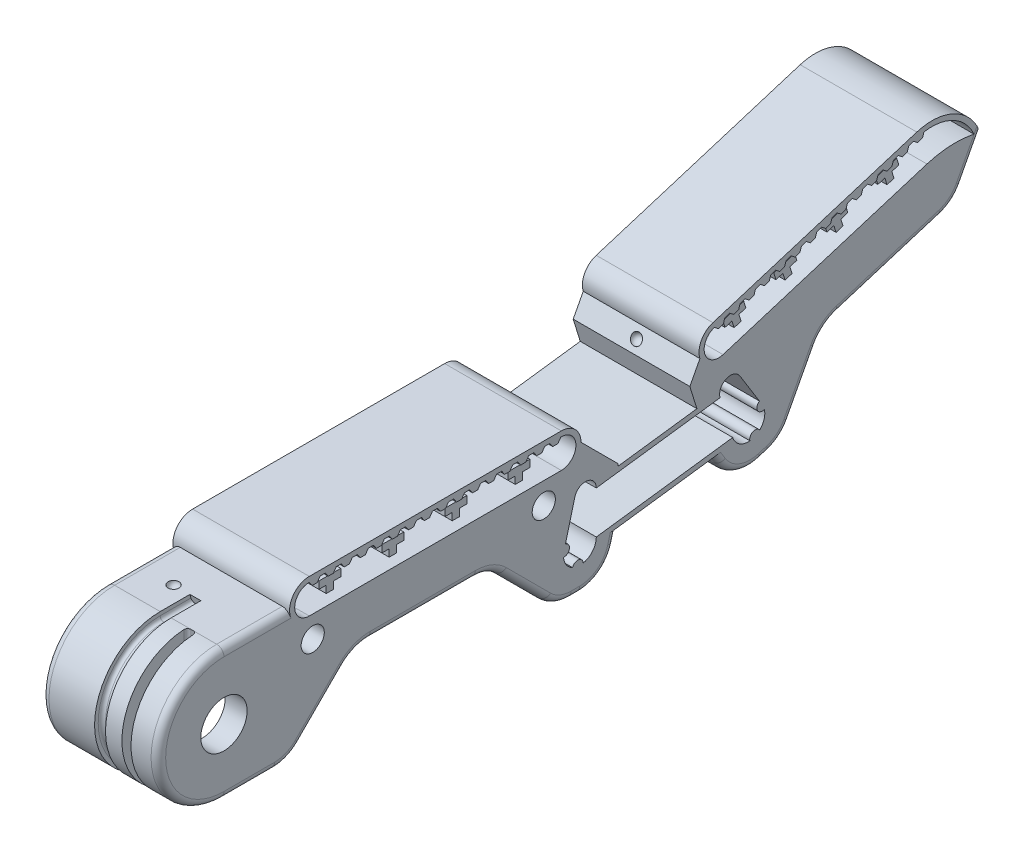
SolidWorks part; units mm, degrees
ref_plane "Front Plane" through (0, 0, 0) normal (0, 0, 1) x (1, 0, 0)
ref_plane "Top Plane" through (0, 0, 0) normal (0, 1, 0) x (1, 0, 0)
ref_plane "Right Plane" through (0, 0, 0) normal (1, 0, 0) x (0, 0, -1)
sketch "Sketch1" plane through (0, 0, 0) normal (1, 0, 0) x (0, 0, -1)
  line L0 (0, 0) -> (54.0462, 0) construction
  line L1 (54.0462, 0) -> (65.9436, 1.5663) construction
  line L2 (65.9436, 1.5663) -> (98.4935, 11.6394) construction
  line L3 (0, 0) -> (59.9949, 0.7832) construction
  line L4 (59.9949, 0.7832) -> (98.4935, 11.6394) construction
  line L5 (0, 3.175) -> (0, -3.175) construction
  line L6 (0, 9) -> (54.0462, 9)
  line L7 (0, -9) -> (54.0462, -9)
  line L8 (54.0462, 9) -> (54.0462, -9) construction
  line L9 (63.2829, 10.164) -> (95.8328, 20.2371)
  line L10 (68.6042, -7.0314) -> (101.1542, 3.0416)
  line L11 (101.1542, 3.0416) -> (95.8328, 20.2371)
  line L12 (63.2829, 10.164) -> (68.6042, -7.0314) construction
  line L13 (54.0462, 9) -> (54.0462, 3.615)
  line L14 (54.0462, 3.615) -> (64.8686, 5.0398)
  line L15 (64.8686, 5.0398) -> (63.2829, 10.164)
  line L16 (54.0462, -9) -> (54.0462, -3.615)
  line L17 (54.0462, -3.615) -> (67.0185, -1.9072)
  line L18 (67.0185, -1.9072) -> (68.6042, -7.0314)
  line L19 (54.0462, 9) -> (63.2829, 10.164) construction
  line L20 (54.0462, -9) -> (68.6042, -7.0314) construction
  circle A0 centre (0, 0) radius 3.175
  arc A1 (0, 9) -> (0, -9) centre (0, 0) ccw
  dimension "D6" = 6.35
  dimension "D7" = 18
  dimension "D1" = 15
  dimension "D2" = 7.5
  dimension "D3" = 60
  dimension "D4" = 40
  dimension "D5" = 12
  dimension "D8" = 18
  dimension "D9" = 7.1681
extrude "Base" add sketch "Sketch1" along normal mid plane 16
sketch "Sketch2" plane through (8, 0, 0) normal (1, 0, 0) x (0, 0, -1)
  line L0 (59.4574, 4.3274) -> (60.5323, -2.7611) construction
  line L1 (64.8686, 5.0398) -> (54.0462, 3.615) construction
  line L2 (54.0462, -3.615) -> (67.0185, -1.9072) construction
  line L3 (54.0462, 3.615) -> (54.0462, -3.615) construction
  line L4 (64.8686, 5.0398) -> (67.0185, -1.9072) construction
  line L5 (54.0462, 0) -> (65.9436, 1.5663) construction
  line L6 (54.0462, 2.909) -> (65.0786, 4.3614)
  line L7 (54.0462, -2.909) -> (66.8085, -1.2288)
  line L8 (54.0462, 2.909) -> (51.0719, 2.5174)
  line L9 (54.0462, -2.909) -> (51.0719, -3.3005)
  line L10 (48.1209, 2.8978) -> (46.6454, -2.7299)
  line L11 (51.0719, 2.5174) -> (51.0719, -3.3005) construction
  line L12 (65.0786, 4.3614) -> (68.0529, 4.753)
  line L13 (66.8085, -1.2288) -> (69.7829, -0.8372)
  line L14 (70.7607, 5.9869) -> (73.8445, 1.0137)
  line L15 (68.0529, 4.753) -> (69.7829, -0.8372) construction
  arc A0 (51.0719, 2.5174) -> (48.1209, 2.8978) centre (49.5719, 2.5174) ccw
  arc A1 (51.0719, -3.3005) -> (46.6454, -2.7299) centre (48.8219, -3.3005) cw
  arc A2 (68.0529, 4.753) -> (70.7607, 5.9869) centre (69.4859, 5.1964) cw
  arc A3 (69.7829, -0.8372) -> (73.8445, 1.0137) centre (71.9323, -0.172) ccw
  point P14 (59.9949, 0.7832)
  dimension "D3" = 1.5
  dimension "D4" = 2.25
  dimension "D1" = 0.7
  dimension "D2" = 3
extrude "Flexure" cut sketch "Sketch2" against normal through all
sketch "Sketch3" plane through (8, 0, 0) normal (1, 0, 0) x (0, 0, -1)
  line L0 (46.6454, -2.7299) -> (51.0719, -3.3005) construction
  line L1 (69.7829, -0.8372) -> (73.8445, 1.0137) construction
  line L2 (48.8587, -3.0152) -> (48.5342, -5.5321) construction
  line L3 (71.8137, 0.0883) -> (72.8653, -2.2194) construction
  arc A0 (46.6454, -2.7299) -> (51.0719, -3.3005) centre (48.8219, -3.3005) ccw construction
  arc A1 (69.7829, -0.8372) -> (73.8445, 1.0137) centre (71.9323, -0.172) ccw construction
  circle A2 centre (46.6454, -2.7299) radius 0.75
  circle A3 centre (48.5342, -5.5321) radius 0.75
  circle A4 centre (72.8653, -2.2194) radius 0.75
  circle A5 centre (73.8445, 1.0137) radius 0.75
  dimension "D1" = 1.5
extrude "Flexure Anchors" add sketch "Sketch3" against normal up to surface (16 mm away)
sketch "Sketch4" plane through (8, 0, 0) normal (1, 0, 0) x (0, 0, -1)
  line L0 (27.0231, -9) -> (27.0231, 9) construction
  line L1 (0, -9) -> (54.0462, -9) construction
  line L2 (54.0462, 9) -> (0, 9) construction
  line L3 (-8.0536, 4.0174) -> (54.0462, 4.0174) construction
  line L4 (54.0462, 3.615) -> (54.0462, 9) construction
  line L5 (48.1209, 2.8978) -> (46.8357, -2.0044) construction
  line L6 (44.9883, 2.8948) -> (51.0934, 9) construction
  line L7 (48.9721, 9) -> (54.0462, 3.9259)
  line L8 (54.0462, 3.9259) -> (54.0462, 9)
  line L9 (54.0462, 9) -> (48.9721, 9)
  line L10 (63.2829, 10.164) -> (63.902, 8.1634)
  line L11 (63.2829, 10.164) -> (64.8686, 5.0398) construction
  line L12 (63.902, 8.1634) -> (65.2835, 10.7831)
  line L13 (95.8328, 20.2371) -> (63.2829, 10.164) construction
  line L14 (65.2835, 10.7831) -> (63.2829, 10.164)
  line L15 (59.5624, 3.6352) -> (60.4274, -2.0689) construction
  line L16 (68.0529, 4.753) -> (51.0719, 2.5174) construction
  line L17 (51.0719, -3.3005) -> (69.7829, -0.8372) construction
  line L18 (59.9949, 0.7832) -> (72.9314, 2.4863) construction
  line L19 (73.4493, 1.6511) -> (70.7607, 5.9869) construction
  arc A0 (0, 9) -> (0, -9) centre (0, 0) ccw construction
  arc A1 (51.0719, 2.5174) -> (48.1209, 2.8978) centre (49.5719, 2.5174) ccw construction
  circle A2 centre (43.8657, 4.0174) radius 1.5875
  circle A3 centre (12.175, 4.0174) radius 1.5875
  circle A6 centre (0, 0) radius 3.175 construction
  point P38 (64.5838, 9.4563)
  dimension "D1" = 3.175
  dimension "D2" = 4.4
  dimension "D5" = 12.175
  dimension "D4" = 1.5
  dimension "D6" = 1.5
  dimension "D7" = 8
extrude "Pin Holes" cut sketch "Sketch4" against normal through all
sketch "Sketch5" plane through (0, 28.9861, -28.9861) normal (0, 0.7071, -0.7071) x (1, 0, 0)
  line L0 (0, 28.2646) -> (0, 35.4404) construction
  line L1 (-8, 28.2646) -> (8, 28.2646) construction
  line L2 (-8, 35.4404) -> (8, 35.4404) construction
  circle A0 centre (0, 29.7646) radius 0.75
  dimension "D1" = 1.5
  dimension "D2" = 1.5
extrude "Tendon Route 1" cut sketch "Sketch5" against normal blind 0.75
sketch "Sketch6" plane through (0, -24.5899, -46.6298) normal (0, 0.4665, 0.8845) x (1, 0, 0)
  line L0 (0, 39.9901) -> (0, 37.0285) construction
  line L1 (-8, 39.9901) -> (8, 39.9901) construction
  line L2 (-8, 37.0285) -> (8, 37.0285) construction
  circle A0 centre (0, 38.4901) radius 0.75
  dimension "D1" = 1.5
  dimension "D2" = 1.5
extrude "Tendon Route 2" cut sketch "Sketch6" against normal blind 0.75
sketch "Sketch10" plane through (8, 0, 0) normal (1, 0, 0) x (0, 0, -1)
  line L0 (11.7, 11.7) -> (46.2721, 11.7)
  line L1 (48.9721, 9) -> (0, 9) construction
  line L2 (9, 9) -> (48.9721, 9)
  line L3 (65.2835, 10.7831) -> (95.8328, 20.2371)
  line L4 (67.0646, 14.1607) -> (95.0346, 22.8164)
  line L5 (95.8328, 20.2371) -> (95.0346, 22.8164) construction
  line L6 (101.1542, 3.0416) -> (95.8328, 20.2371) construction
  line L7 (95.8328, 20.2371) -> (99.1735, 9.4422)
  arc A0 (46.2721, 11.7) -> (48.9721, 9) centre (46.2721, 9) cw
  arc A1 (11.7, 11.7) -> (9, 9) centre (11.7, 9) ccw
  arc A2 (65.2835, 10.7831) -> (67.0646, 14.1607) centre (67.8628, 11.5813) cw
  arc A3 (95.0346, 22.8164) -> (99.1735, 9.4422) centre (97.104, 16.1293) cw
  dimension "D3" = 7
  dimension "D1" = 2.7
  dimension "D2" = 9
extrude "Finger Pad Outline" add sketch "Sketch10" against normal up to surface (16 mm away)
sketch "Sketch11" plane through (8, 0, 0) normal (1, 0, 0) x (0, 0, -1)
  line L0 (82.3148, 6.1037) -> (100.3574, 11.6873)
  line L1 (68.6042, -7.0314) -> (101.1542, 3.0416) construction
  line L2 (76.711, -4.5226) -> (107.8413, 5.1111)
  line L3 (107.8413, 5.1111) -> (103.7911, 18.1987)
  line L4 (68.0529, 4.753) -> (69.7829, -0.8372) construction
  line L5 (68.9179, 1.9579) -> (103.114, 12.5404) construction
  line L6 (82.3148, 6.1037) -> (76.711, -4.5226)
  line L7 (63.902, 8.1634) -> (65.2835, 10.7831) construction
  line L8 (67.0185, -1.9072) -> (68.6042, -7.0314)
  line L9 (68.6042, -7.0314) -> (69.9397, -6.6181)
  line L10 (69.9397, -6.6181) -> (67.0185, -1.9072)
  line L11 (73.4493, 1.6511) -> (70.7607, 5.9869) construction
  line L12 (69.9397, -6.6181) -> (76.711, -4.5226) construction
  line L13 (54.0462, -3.615) -> (52.6344, -9)
  line L14 (0, -9) -> (54.0462, -9) construction
  line L15 (52.6344, -9) -> (54.0462, -9)
  line L16 (54.0462, -9) -> (54.0462, -3.615)
  line L17 (48.1209, 2.8978) -> (46.8357, -2.0044) construction
  line L18 (9, 9) -> (9, -9) construction
  line L19 (0, 0) -> (47.3612, 0) construction
  line L20 (9, -9) -> (18, 0)
  line L21 (18, 0) -> (36.5462, 0)
  line L22 (36.5462, 0) -> (45.5462, -9)
  line L23 (45.5462, -9) -> (52.6344, -9)
  line L24 (48.9721, 9) -> (54.0462, 3.9259) construction
  line L25 (51.0719, 2.5174) -> (51.0719, -3.3005) construction
  line L26 (9, -9) -> (45.5462, -9)
  line L27 (100.3574, 11.6873) -> (103.7911, 18.1987)
  arc A0 (99.1735, 9.4422) -> (95.0346, 22.8164) centre (97.104, 16.1293) ccw construction
  dimension "D1" = 8.5
extrude "Finger Outline" cut sketch "Sketch11" against normal through all
sketch "Sketch12" plane through (8, 0, 0) normal (1, 0, 0) x (0, 0, -1)
  line L0 (9, 9) -> (48.9721, 9) construction
  line L1 (65.2835, 10.7831) -> (101.1095, 21.87) construction
  line L2 (95.0346, 22.8164) -> (67.0646, 14.1607) construction
  line L3 (11.7, 11.7) -> (11.7, 6.3) construction
  line L4 (11.7, 11) -> (46.2721, 11)
  line L5 (46.2721, 11.7) -> (46.2721, 6.3) construction
  line L6 (46.2721, 11.7) -> (11.7, 11.7) construction
  line L7 (11.7, 7) -> (46.2721, 7)
  line L8 (67.0646, 14.1607) -> (68.8973, 8.2385) construction
  line L9 (67.2715, 13.492) -> (95.2416, 22.1477)
  line L10 (68.454, 9.6707) -> (96.4241, 18.3265)
  line L11 (95.0346, 22.8164) -> (97.8556, 13.7007) construction
  line L13 (103.7911, 18.1987) -> (62.4469, 5.4041) construction
  line L14 (63.902, 8.1634) -> (65.2835, 10.7831) construction
  arc A0 (103.7911, 18.1987) -> (95.0346, 22.8164) centre (97.104, 16.1293) ccw construction
  arc A1 (11.7, 11) -> (11.7, 7) centre (11.7, 9) ccw
  arc A2 (46.2721, 11) -> (46.2721, 7) centre (46.2721, 9) cw
  arc A3 (67.2715, 13.492) -> (68.454, 9.6707) centre (67.8628, 11.5813) ccw
  arc A4 (95.2416, 22.1477) -> (102.8782, 18.6489) centre (97.104, 16.1293) cw
  arc A5 (96.4241, 18.3265) -> (102.8782, 18.6489) centre (100.2821, 5.8598) cw
  dimension "D1" = 0.7
  dimension "D2" = 0.7
  dimension "D3" = 0.7
extrude "Finger Pad Cavity" cut sketch "Sketch12" against normal through all
sketch "Sketch15" plane through (0, 0, 0) normal (1, 0, 0) x (0, 0, -1)
  line L0 (28.9861, 11) -> (28.9861, 7) construction
  line L1 (11.7, 7) -> (11.7, 11) construction
  line L2 (46.2721, 11) -> (46.2721, 7) construction
  line L3 (67.2715, 13.492) -> (68.454, 9.6707) construction
  line L4 (95.2416, 22.1477) -> (96.4241, 18.3265) construction
  line L5 (46.2721, 11) -> (11.7, 11) construction
  line L6 (11.7, 7) -> (46.2721, 7) construction
  line L7 (82.4391, 13.9986) -> (81.2565, 17.8198) construction
  line L8 (68.454, 9.6707) -> (96.4241, 18.3265) construction
  line L9 (95.2416, 22.1477) -> (67.2715, 13.492) construction
  line L10 (11.7, 11) -> (28.9861, 11) construction
  line L11 (20.343, 11) -> (20.343, 7) construction
  line L12 (11.7, 9) -> (20.343, 9) construction
  line L13 (16.0215, 9) -> (16.0215, 7) construction
  line L14 (67.2715, 13.492) -> (81.2565, 17.8198) construction
  line L15 (74.264, 15.6559) -> (75.4466, 11.8347) construction
  line L16 (67.8628, 11.5813) -> (74.8553, 13.7453) construction
  line L17 (71.359, 12.6633) -> (71.9503, 10.7527) construction
  line L18 (14.5215, 9) -> (17.5215, 9)
  line L19 (17.5215, 9) -> (17.5215, 8)
  line L20 (17.5215, 8) -> (16.5215, 8)
  line L21 (16.5215, 8) -> (16.5215, 7)
  line L22 (16.5215, 7) -> (15.5215, 7)
  line L23 (15.5215, 7) -> (15.5215, 8)
  line L24 (15.5215, 8) -> (14.5215, 8)
  line L25 (14.5215, 8) -> (14.5215, 9)
  line L26 (24.6645, 9) -> (24.6645, 7) construction
  line L27 (26.1645, 8) -> (26.1645, 9)
  line L28 (25.1645, 8) -> (26.1645, 8)
  line L29 (25.1645, 7) -> (25.1645, 8)
  line L30 (24.1645, 7) -> (25.1645, 7)
  line L31 (24.1645, 8) -> (24.1645, 7)
  line L32 (23.1645, 8) -> (24.1645, 8)
  line L33 (23.1645, 9) -> (23.1645, 8)
  line L34 (26.1645, 9) -> (23.1645, 9)
  line L35 (33.3076, 9) -> (33.3076, 7) construction
  line L36 (31.8076, 9) -> (34.8076, 9)
  line L37 (34.8076, 9) -> (34.8076, 8)
  line L38 (34.8076, 8) -> (33.8076, 8)
  line L39 (33.8076, 8) -> (33.8076, 7)
  line L40 (33.8076, 7) -> (32.8076, 7)
  line L41 (32.8076, 7) -> (32.8076, 8)
  line L42 (32.8076, 8) -> (31.8076, 8)
  line L43 (31.8076, 8) -> (31.8076, 9)
  line L44 (41.9506, 9) -> (41.9506, 7) construction
  line L45 (43.4506, 8) -> (43.4506, 9)
  line L46 (42.4506, 8) -> (43.4506, 8)
  line L47 (42.4506, 7) -> (42.4506, 8)
  line L48 (41.4506, 7) -> (42.4506, 7)
  line L49 (41.4506, 8) -> (41.4506, 7)
  line L50 (40.4506, 8) -> (41.4506, 8)
  line L51 (40.4506, 9) -> (40.4506, 8)
  line L52 (43.4506, 9) -> (40.4506, 9)
  line L53 (69.9261, 12.2199) -> (70.2217, 11.2646)
  line L54 (70.2217, 11.2646) -> (71.177, 11.5602)
  line L55 (71.177, 11.5602) -> (71.4726, 10.6049)
  line L56 (71.4726, 10.6049) -> (72.4279, 10.9005)
  line L57 (72.4279, 10.9005) -> (72.1323, 11.8558)
  line L58 (72.1323, 11.8558) -> (73.0876, 12.1515)
  line L59 (73.0876, 12.1515) -> (72.792, 13.1068)
  line L60 (72.792, 13.1068) -> (69.9261, 12.2199)
  line L61 (78.3515, 14.8272) -> (78.9428, 12.9166) construction
  line L62 (76.9186, 14.3838) -> (79.7845, 15.2707)
  line L63 (77.2142, 13.4285) -> (76.9186, 14.3838)
  line L64 (78.1695, 13.7241) -> (77.2142, 13.4285)
  line L65 (78.4652, 12.7688) -> (78.1695, 13.7241)
  line L66 (79.4205, 13.0645) -> (78.4652, 12.7688)
  line L67 (79.1248, 14.0198) -> (79.4205, 13.0645)
  line L68 (80.0801, 14.3154) -> (79.1248, 14.0198)
  line L69 (79.7845, 15.2707) -> (80.0801, 14.3154)
  line L70 (85.3441, 16.9912) -> (85.9353, 15.0806) construction
  line L71 (83.9111, 16.5477) -> (84.2067, 15.5924)
  line L72 (84.2067, 15.5924) -> (85.162, 15.8881)
  line L73 (85.162, 15.8881) -> (85.4577, 14.9328)
  line L74 (85.4577, 14.9328) -> (86.413, 15.2284)
  line L75 (86.413, 15.2284) -> (86.1173, 16.1837)
  line L76 (86.1173, 16.1837) -> (87.0726, 16.4793)
  line L77 (87.0726, 16.4793) -> (86.777, 17.4346)
  line L78 (86.777, 17.4346) -> (83.9111, 16.5477)
  line L79 (92.3366, 19.1551) -> (92.9278, 17.2445) construction
  line L80 (90.9036, 18.7117) -> (93.7695, 19.5986)
  line L81 (91.1992, 17.7564) -> (90.9036, 18.7117)
  line L82 (92.1545, 18.052) -> (91.1992, 17.7564)
  line L83 (92.4502, 17.0967) -> (92.1545, 18.052)
  line L84 (93.4055, 17.3923) -> (92.4502, 17.0967)
  line L85 (93.1098, 18.3476) -> (93.4055, 17.3923)
  line L86 (94.0651, 18.6432) -> (93.1098, 18.3476)
  line L87 (93.7695, 19.5986) -> (94.0651, 18.6432)
extrude "Finger Pad Hooks" add sketch "Sketch15" along normal mid plane 13
sketch "Sketch16" plane through (8, 0, 0) normal (1, 0, 0) x (0, 0, -1)
  line L0 (11.7, 11.7) -> (11.7, 11) construction
  line L1 (11.7, 11) -> (12.1, 10.4255)
  line L2 (12.1, 10.4255) -> (12.8, 10.4255)
  line L3 (12.8, 10.4255) -> (13.2, 11)
  line L4 (46.2721, 11) -> (11.7, 11) construction
  line L5 (13.2, 11) -> (11.7, 11)
  line L6 (13.9, 11) -> (14.3, 10.4255)
  line L7 (14.3, 10.4255) -> (15, 10.4255)
  line L8 (15, 10.4255) -> (15.4, 11)
  line L9 (15.4, 11) -> (13.9, 11)
  line L10 (16.1, 11) -> (16.5, 10.4255)
  line L11 (16.5, 10.4255) -> (17.2, 10.4255)
  line L12 (17.2, 10.4255) -> (17.6, 11)
  line L13 (17.6, 11) -> (16.1, 11)
  line L14 (18.3, 11) -> (18.7, 10.4255)
  line L15 (18.7, 10.4255) -> (19.4, 10.4255)
  line L16 (19.4, 10.4255) -> (19.8, 11)
  line L17 (19.8, 11) -> (18.3, 11)
  line L18 (20.5, 11) -> (20.9, 10.4255)
  line L19 (20.9, 10.4255) -> (21.6, 10.4255)
  line L20 (21.6, 10.4255) -> (22, 11)
  line L21 (22, 11) -> (20.5, 11)
  line L22 (22.7, 11) -> (23.1, 10.4255)
  line L23 (23.1, 10.4255) -> (23.8, 10.4255)
  line L24 (23.8, 10.4255) -> (24.2, 11)
  line L25 (24.2, 11) -> (22.7, 11)
  line L26 (24.9, 11) -> (25.3, 10.4255)
  line L27 (25.3, 10.4255) -> (26, 10.4255)
  line L28 (26, 10.4255) -> (26.4, 11)
  line L29 (26.4, 11) -> (24.9, 11)
  line L30 (27.1, 11) -> (27.5, 10.4255)
  line L31 (27.5, 10.4255) -> (28.2, 10.4255)
  line L32 (28.2, 10.4255) -> (28.6, 11)
  line L33 (28.6, 11) -> (27.1, 11)
  line L34 (29.3, 11) -> (29.7, 10.4255)
  line L35 (29.7, 10.4255) -> (30.4, 10.4255)
  line L36 (30.4, 10.4255) -> (30.8, 11)
  line L37 (30.8, 11) -> (29.3, 11)
  line L38 (31.5, 11) -> (31.9, 10.4255)
  line L39 (31.9, 10.4255) -> (32.6, 10.4255)
  line L40 (32.6, 10.4255) -> (33, 11)
  line L41 (33, 11) -> (31.5, 11)
  line L42 (33.7, 11) -> (34.1, 10.4255)
  line L43 (34.1, 10.4255) -> (34.8, 10.4255)
  line L44 (34.8, 10.4255) -> (35.2, 11)
  line L45 (35.2, 11) -> (33.7, 11)
  line L46 (35.9, 11) -> (36.3, 10.4255)
  line L47 (36.3, 10.4255) -> (37, 10.4255)
  line L48 (37, 10.4255) -> (37.4, 11)
  line L49 (37.4, 11) -> (35.9, 11)
  line L50 (38.1, 11) -> (38.5, 10.4255)
  line L51 (38.5, 10.4255) -> (39.2, 10.4255)
  line L52 (39.2, 10.4255) -> (39.6, 11)
  line L53 (39.6, 11) -> (38.1, 11)
  line L54 (40.3, 11) -> (40.7, 10.4255)
  line L55 (40.7, 10.4255) -> (41.4, 10.4255)
  line L56 (41.4, 10.4255) -> (41.8, 11)
  line L57 (41.8, 11) -> (40.3, 11)
  line L58 (42.5, 11) -> (42.9, 10.4255)
  line L59 (42.9, 10.4255) -> (43.6, 10.4255)
  line L60 (43.6, 10.4255) -> (44, 11)
  line L61 (44, 11) -> (42.5, 11)
  line L62 (44.7, 11) -> (45.1, 10.4255)
  line L63 (45.1, 10.4255) -> (45.8, 10.4255)
  line L64 (45.8, 10.4255) -> (46.2, 11)
  line L65 (46.2, 11) -> (44.7, 11)
  line L66 (67.0646, 14.1607) -> (67.2715, 13.492) construction
  line L67 (67.2715, 13.492) -> (67.8235, 13.0614)
  line L68 (67.8235, 13.0614) -> (68.4922, 13.2684)
  line L69 (68.4922, 13.2684) -> (68.7045, 13.9354)
  line L70 (95.2416, 22.1477) -> (67.2715, 13.492) construction
  line L71 (68.7045, 13.9354) -> (67.2715, 13.492)
  line L72 (69.3732, 14.1423) -> (69.9251, 13.7118)
  line L73 (69.9251, 13.7118) -> (70.5938, 13.9188)
  line L74 (70.5938, 13.9188) -> (70.8061, 14.5858)
  line L75 (70.8061, 14.5858) -> (69.3732, 14.1423)
  line L76 (69.1662, 14.8111) -> (69.3732, 14.1423) construction
  line L77 (71.4748, 14.7927) -> (72.0268, 14.3622)
  line L78 (72.0268, 14.3622) -> (72.6955, 14.5691)
  line L79 (72.6955, 14.5691) -> (72.9078, 15.2362)
  line L80 (72.9078, 15.2362) -> (71.4748, 14.7927)
  line L81 (71.2679, 15.4614) -> (71.4748, 14.7927) construction
  line L82 (73.5765, 15.4431) -> (74.1285, 15.0126)
  line L83 (74.1285, 15.0126) -> (74.7972, 15.2195)
  line L84 (74.7972, 15.2195) -> (75.0095, 15.8866)
  line L85 (75.0095, 15.8866) -> (73.5765, 15.4431)
  line L86 (73.3696, 16.1118) -> (73.5765, 15.4431) construction
  line L87 (75.6782, 16.0935) -> (76.2301, 15.663)
  line L88 (76.2301, 15.663) -> (76.8988, 15.8699)
  line L89 (76.8988, 15.8699) -> (77.1111, 16.537)
  line L90 (77.1111, 16.537) -> (75.6782, 16.0935)
  line L91 (75.4712, 16.7622) -> (75.6782, 16.0935) construction
  line L92 (77.7798, 16.7439) -> (78.3318, 16.3134)
  line L93 (78.3318, 16.3134) -> (79.0005, 16.5203)
  line L94 (79.0005, 16.5203) -> (79.2128, 17.1873)
  line L95 (79.2128, 17.1873) -> (77.7798, 16.7439)
  line L96 (77.5729, 17.4126) -> (77.7798, 16.7439) construction
  line L97 (79.8815, 17.3943) -> (80.4334, 16.9638)
  line L98 (80.4334, 16.9638) -> (81.1022, 17.1707)
  line L99 (81.1022, 17.1707) -> (81.3145, 17.8377)
  line L100 (81.3145, 17.8377) -> (79.8815, 17.3943)
  line L101 (79.6746, 18.063) -> (79.8815, 17.3943) construction
  line L102 (81.9832, 18.0447) -> (82.5351, 17.6142)
  line L103 (82.5351, 17.6142) -> (83.2038, 17.8211)
  line L104 (83.2038, 17.8211) -> (83.4161, 18.4881)
  line L105 (83.4161, 18.4881) -> (81.9832, 18.0447)
  line L106 (81.7762, 18.7134) -> (81.9832, 18.0447) construction
  line L107 (84.0848, 18.6951) -> (84.6368, 18.2645)
  line L108 (84.6368, 18.2645) -> (85.3055, 18.4715)
  line L109 (85.3055, 18.4715) -> (85.5178, 19.1385)
  line L110 (85.5178, 19.1385) -> (84.0848, 18.6951)
  line L111 (83.8779, 19.3638) -> (84.0848, 18.6951) construction
  line L112 (86.1865, 19.3455) -> (86.7384, 18.9149)
  line L113 (86.7384, 18.9149) -> (87.4072, 19.1219)
  line L114 (87.4072, 19.1219) -> (87.6194, 19.7889)
  line L115 (87.6194, 19.7889) -> (86.1865, 19.3455)
  line L116 (85.9796, 20.0142) -> (86.1865, 19.3455) construction
  line L117 (88.2882, 19.9958) -> (88.8401, 19.5653)
  line L118 (88.8401, 19.5653) -> (89.5088, 19.7723)
  line L119 (89.5088, 19.7723) -> (89.7211, 20.4393)
  line L120 (89.7211, 20.4393) -> (88.2882, 19.9958)
  line L121 (88.0812, 20.6646) -> (88.2882, 19.9958) construction
  line L122 (90.3898, 20.6462) -> (90.9418, 20.2157)
  line L123 (90.9418, 20.2157) -> (91.6105, 20.4227)
  line L124 (91.6105, 20.4227) -> (91.8228, 21.0897)
  line L125 (91.8228, 21.0897) -> (90.3898, 20.6462)
  line L126 (90.1829, 21.3149) -> (90.3898, 20.6462) construction
  line L127 (92.4915, 21.2966) -> (93.0434, 20.8661)
  line L128 (93.0434, 20.8661) -> (93.7121, 21.073)
  line L129 (93.7121, 21.073) -> (93.9244, 21.7401)
  line L130 (93.9244, 21.7401) -> (92.4915, 21.2966)
  line L131 (92.2845, 21.9653) -> (92.4915, 21.2966) construction
  line L132 (94.5932, 21.947) -> (95.1451, 21.5165)
  line L133 (95.1451, 21.5165) -> (95.8138, 21.7234)
  line L134 (95.8138, 21.7234) -> (96.0261, 22.3905)
  line L135 (96.0261, 22.3905) -> (94.5932, 21.947)
  line L136 (94.3862, 22.6157) -> (94.5932, 21.947) construction
  dimension "D1" = 1.5
  dimension "D2" = 0.7
  dimension "D3" = 16
  dimension "D4" = 14
extrude "Ridges" add sketch "Sketch16" against normal up to surface (16 mm away)
sketch "Sketch20" plane through (0, 0, 0) normal (1, 0, 0) x (0, 0, -1)
  line L0 (0, 5) -> (10.1093, 5)
  line L1 (0, -9) -> (0, -5)
  line L2 (0, -9) -> (41.5621, -9)
  line L3 (43.8657, 4.0174) -> (74.7188, 8.0793) construction
  line L4 (12.175, 6.3049) -> (43.8657, 6.3049)
  line L5 (41.5621, -9) -> (46.0153, 3.235)
  line L7 (41.5621, -9) -> (52.6344, -9) construction
  line L8 (80.517, -3.3448) -> (69.9397, -6.6181) construction
  line L9 (80.517, -3.3448) -> (107.4143, 4.9789)
  line L10 (69.9397, -6.6181) -> (76.711, -4.5226) construction
  line L11 (80.517, -3.3448) -> (72.8966, 6.6964)
  line L13 (64.8686, 5.0398) -> (54.0462, 3.615) construction
  line L15 (97.8189, 17.6224) -> (74.0425, 10.2645)
  line L16 (97.8189, 17.6224) -> (107.4143, 4.9789)
  circle A0 centre (0, 0) radius 9 construction
  circle A1 centre (12.175, 4.0174) radius 2.2875 construction
  circle A2 centre (43.8657, 4.0174) radius 2.2875 construction
  arc A3 (12.175, 6.3049) -> (10.1093, 5) centre (12.175, 4.0174) ccw
  arc A4 (0, 9) -> (0, -9) centre (0, 0) ccw construction
  circle A5 centre (0, 0) radius 5 construction
  arc A6 (0, 5) -> (0, -5) centre (0, 0) ccw
  arc A7 (43.8657, 6.3049) -> (46.0153, 3.235) centre (43.8657, 4.0174) cw
  circle A8 centre (12.175, 4.0174) radius 1.5875 construction
  arc A9 (74.0425, 10.2645) -> (72.8966, 6.6964) centre (74.7188, 8.0793) ccw
  dimension "D1" = 0.7
  dimension "D2" = 10
  dimension "D3" = 6
  dimension "D4" = 70
  dimension "D5" = 70
extrude "Finger Back Cutaway" cut sketch "Sketch20" against normal mid plane 10
sketch "Sketch21" plane through (0, 0, 0) normal (1, 0, 0) x (0, 0, -1)
  line L0 (0, 9) -> (11.7, 9) construction
  line L1 (11.2106, 2.7564) -> (3.0472, 9) construction
  line L2 (0, 9) -> (0, -9) construction
  line L3 (0, 0) -> (0, -9) construction
  line L4 (0, 8) -> (4.3547, 8)
  line L5 (3.0472, 10.7356) -> (3.0472, 6.5349) construction
  line L6 (0, -8) -> (0, -9)
  line L7 (4.3547, 8) -> (4.0833, 9)
  line L8 (4.0833, 9) -> (0, 9)
  circle A0 centre (12.175, 4.0174) radius 1.5875 construction
  circle A1 centre (12.175, 4.0174) radius 1.5875 construction
  circle A2 centre (0, 0) radius 9 construction
  arc A3 (0, 9) -> (0, -9) centre (0, 0) ccw construction
  arc A4 (0, 9) -> (0, -9) centre (0, 0) ccw
  arc A5 (0, 8) -> (0, -8) centre (0, 0) ccw
  dimension "D1" = 8
extrude "Tendon Track" cut sketch "Sketch21" against normal mid plane 1.5
sketch "Sketch22" plane through (0, 0, 0) normal (0, 0, -1) x (-1, 0, 0)
  line L0 (-0.75, -9) -> (-5, -9) construction
  line L1 (-4.25, 9) -> (-3, 9)
  line L2 (-4.25, 9) -> (-4.25, -9)
  line L3 (-4.25, -9) -> (-3, -9)
  line L4 (-3, 9) -> (-3, -9)
  line L5 (-8, 9) -> (-0.75, 9) construction
  line L6 (5, -5) -> (-5, -5) construction
  line L7 (5, -5) -> (-5, -5) construction
  line L8 (0, 0) -> (0, -5) construction
  dimension "D1" = 1.25
  dimension "D2" = 3
extrude "Torsion Spring Clearance" cut sketch "Sketch22" against normal through all
sketch "Sketch24" plane through (0, 9, 0) normal (0, 1, 0) x (1, 0, 0)
  line L0 (-8, 4.0833) -> (8, 4.0833) construction
  line L1 (-8, 9) -> (-8, 0) construction
  line L2 (8, 9) -> (8, 0) construction
  line L3 (-0.75, 4.0833) -> (0.75, 4.0833) construction
  line L4 (-0.75, 0) -> (-8, 0) construction
  line L7 (-8, 9) -> (8, 9) construction
  line L9 (-3, 0) -> (-3, 4.0833) construction
  line L10 (0, 0) -> (0, 9) construction
  circle A0 centre (-3, 4.0833) radius 0.75
  dimension "D1" = 1.5
  dimension "D2" = 3
extrude "Torsion Spring Route" cut sketch "Sketch24" against normal blind 0.75
fillet "Tendon Route Fillet" radius 0.75 3 edges at (0, 8.4431, -64.8973) (0, 7.9393, -48.9721) (-3, 8.25, -3.3333)
fillet "Tendon Track Contouring" radius 0.5 8 edges at (0.75, 0, 8) (0.75, 8, -2.1773) (-0.75, 8, -2.1773) (-0.75, 0, 8) (4.25, 7, 0) (3, 7, 0) (-1, -5, 0) (3, -7, 0)
fillet "Finger Contouring" radius 5 14 edges at (0, -4.5226, -76.711) (0, -9, -45.5462) (-6.5, 0, -36.5462) (6.5, 0, -36.5462) (6.5, 0, -18) (-6.5, 0, -18) (-6.5, -9, -9) (6.5, -9, -9) (0, -6.6181, -69.9397) (0, -9, -52.6344) (0, 17.6224, -97.8189) (-6.5, 11.6873, -100.3574) (-6.5, 6.1037, -82.3148) (6.5, 6.1037, -82.3148)
fillet "Contouring" radius 1 44 edges at (-8, -4.4415, -53.8295) (-8, -7.9586, -51.8308) (-8, -9, -48.1968) (-8, -8.6194, -45.7039) (-8, -4.5, -41.0462) (-8, -0.3806, -36.3886) (-8, 0, -27.2731) (-8, -0.3806, -18.1577) (-8, -4.5, -13.5) (-8, -8.6194, -8.8423) (-8, -9, -3.4645) (-8, 0, 9) (8, -4.4415, -53.8295) (8, -7.9586, -51.8308) (8, -9, -48.1968) (8, -8.6194, -45.7039) (8, -4.5, -41.0462) (8, -0.3806, -36.3886) (8, 0, -27.2731) (8, -0.3806, -18.1577) (8, -4.5, -13.5) (8, -8.6194, -8.8423) (8, -9, -3.4645) (8, 0, 9) (-8, 9, -4.5) (8, 9, -4.5) (-8, -5.3054, -74.1817) (8, -5.3054, -74.1817) (-8, -4.2057, -76.4479) (-8, -5.3826, -70.4017) (-8, -2.6207, -67.461) (-8, 0.7906, -79.5129) (8, 0.7906, -79.5129) (8, -4.2057, -76.4479) (8, -5.3826, -70.4017) (8, -2.6207, -67.461) (-8, 15.859, -102.5573) (-8, 12.0043, -100.0943) (-8, 8.8955, -91.3361) (-8, 5.7868, -82.5779) (8, 15.859, -102.5573) (8, 12.0043, -100.0943) (8, 8.8955, -91.3361) (8, 5.7868, -82.5779)
sketch "Sketch17" plane through (8, 0, 0) normal (1, 0, 0) x (0, 0, -1)
  line L0 (12.1, 10.4255) -> (12.8, 10.4255) construction
  line L1 (12.8, 10.4255) -> (13.2, 11) construction
  line L2 (13.9, 11) -> (13.2, 11) construction
  line L3 (12.1, 10.4255) -> (12.8, 10.4255)
  line L4 (12.8, 10.4255) -> (13.2, 11)
  line L5 (13.9, 11) -> (13.2, 11)
  line L6 (68.0529, 4.753) -> (51.0719, 2.5174) construction
  line L7 (68.0529, 4.753) -> (51.0719, 2.5174)
  line L10 (51.0719, -3.3005) -> (69.7829, -0.8372)
  line L11 (48.1209, 2.8978) -> (46.8357, -2.0044)
  line L12 (68.0529, 4.753) -> (51.0719, 2.5174)
  line L13 (73.4493, 1.6511) -> (70.7607, 5.9869)
  line L14 (51.0719, -3.3005) -> (69.7829, -0.8372)
  line L15 (48.1209, 2.8978) -> (46.8357, -2.0044)
  line L16 (68.0529, 4.753) -> (51.0719, 2.5174)
  line L17 (73.4493, 1.6511) -> (70.7607, 5.9869)
  line L52 (69.3732, 14.1423) -> (68.7045, 13.9354)
  line L56 (68.454, 9.6707) -> (96.4241, 18.3265)
  line L57 (67.8235, 13.0614) -> (67.2715, 13.492)
  line L58 (68.4922, 13.2684) -> (67.8235, 13.0614)
  line L59 (68.7045, 13.9354) -> (68.4922, 13.2684)
  line L65 (12.1, 10.4255) -> (11.7, 11)
  line L66 (12.8, 10.4255) -> (12.1, 10.4255)
  line L67 (13.2, 11) -> (12.8, 10.4255)
  line L68 (13.9, 11) -> (13.2, 11)
  line L69 (14.3, 10.4255) -> (13.9, 11)
  line L70 (15, 10.4255) -> (14.3, 10.4255)
  line L71 (15.4, 11) -> (15, 10.4255)
  line L72 (16.1, 11) -> (15.4, 11)
  line L73 (16.5, 10.4255) -> (16.1, 11)
  line L74 (17.2, 10.4255) -> (16.5, 10.4255)
  line L75 (17.6, 11) -> (17.2, 10.4255)
  line L76 (18.3, 11) -> (17.6, 11)
  line L77 (18.7, 10.4255) -> (18.3, 11)
  line L78 (19.4, 10.4255) -> (18.7, 10.4255)
  line L79 (19.8, 11) -> (19.4, 10.4255)
  line L80 (20.5, 11) -> (19.8, 11)
  line L81 (20.9, 10.4255) -> (20.5, 11)
  line L82 (21.6, 10.4255) -> (20.9, 10.4255)
  line L83 (22, 11) -> (21.6, 10.4255)
  line L84 (22.7, 11) -> (22, 11)
  line L85 (23.1, 10.4255) -> (22.7, 11)
  line L86 (23.8, 10.4255) -> (23.1, 10.4255)
  line L87 (24.2, 11) -> (23.8, 10.4255)
  line L88 (24.9, 11) -> (24.2, 11)
  line L89 (25.3, 10.4255) -> (24.9, 11)
  line L90 (26, 10.4255) -> (25.3, 10.4255)
  line L91 (26.4, 11) -> (26, 10.4255)
  line L92 (27.1, 11) -> (26.4, 11)
  line L93 (27.5, 10.4255) -> (27.1, 11)
  line L94 (28.2, 10.4255) -> (27.5, 10.4255)
  line L95 (28.6, 11) -> (28.2, 10.4255)
  line L96 (29.3, 11) -> (28.6, 11)
  line L97 (29.7, 10.4255) -> (29.3, 11)
  line L98 (30.4, 10.4255) -> (29.7, 10.4255)
  line L99 (30.8, 11) -> (30.4, 10.4255)
  line L100 (31.5, 11) -> (30.8, 11)
  line L101 (31.9, 10.4255) -> (31.5, 11)
  line L102 (32.6, 10.4255) -> (31.9, 10.4255)
  line L103 (33, 11) -> (32.6, 10.4255)
  line L104 (33.7, 11) -> (33, 11)
  line L105 (34.1, 10.4255) -> (33.7, 11)
  line L106 (34.8, 10.4255) -> (34.1, 10.4255)
  line L107 (35.2, 11) -> (34.8, 10.4255)
  line L108 (35.9, 11) -> (35.2, 11)
  line L109 (36.3, 10.4255) -> (35.9, 11)
  line L110 (37, 10.4255) -> (36.3, 10.4255)
  line L111 (37.4, 11) -> (37, 10.4255)
  line L112 (38.1, 11) -> (37.4, 11)
  line L113 (38.5, 10.4255) -> (38.1, 11)
  line L114 (39.2, 10.4255) -> (38.5, 10.4255)
  line L115 (39.6, 11) -> (39.2, 10.4255)
  line L116 (40.3, 11) -> (39.6, 11)
  line L117 (40.7, 10.4255) -> (40.3, 11)
  line L118 (41.4, 10.4255) -> (40.7, 10.4255)
  line L119 (41.8, 11) -> (41.4, 10.4255)
  line L120 (42.5, 11) -> (41.8, 11)
  line L121 (42.9, 10.4255) -> (42.5, 11)
  line L122 (43.6, 10.4255) -> (42.9, 10.4255)
  line L123 (44, 11) -> (43.6, 10.4255)
  line L129 (11.7, 7) -> (46.2721, 7)
  line L130 (12.1, 10.4255) -> (11.7, 11)
  line L131 (12.8, 10.4255) -> (12.1, 10.4255)
  line L132 (13.2, 11) -> (12.8, 10.4255)
  line L133 (13.9, 11) -> (13.2, 11)
  line L134 (14.3, 10.4255) -> (13.9, 11)
  line L135 (15, 10.4255) -> (14.3, 10.4255)
  line L136 (15.4, 11) -> (15, 10.4255)
  line L137 (16.1, 11) -> (15.4, 11)
  line L138 (16.5, 10.4255) -> (16.1, 11)
  line L139 (17.2, 10.4255) -> (16.5, 10.4255)
  line L140 (17.6, 11) -> (17.2, 10.4255)
  line L141 (18.3, 11) -> (17.6, 11)
  line L142 (18.7, 10.4255) -> (18.3, 11)
  line L143 (19.4, 10.4255) -> (18.7, 10.4255)
  line L144 (19.8, 11) -> (19.4, 10.4255)
  line L145 (20.5, 11) -> (19.8, 11)
  line L146 (20.9, 10.4255) -> (20.5, 11)
  line L147 (21.6, 10.4255) -> (20.9, 10.4255)
  line L148 (22, 11) -> (21.6, 10.4255)
  line L149 (22.7, 11) -> (22, 11)
  line L150 (23.1, 10.4255) -> (22.7, 11)
  line L151 (23.8, 10.4255) -> (23.1, 10.4255)
  line L152 (24.2, 11) -> (23.8, 10.4255)
  line L153 (24.9, 11) -> (24.2, 11)
  line L154 (25.3, 10.4255) -> (24.9, 11)
  line L155 (26, 10.4255) -> (25.3, 10.4255)
  line L156 (26.4, 11) -> (26, 10.4255)
  line L157 (27.1, 11) -> (26.4, 11)
  line L158 (27.5, 10.4255) -> (27.1, 11)
  line L159 (28.2, 10.4255) -> (27.5, 10.4255)
  line L160 (28.6, 11) -> (28.2, 10.4255)
  line L161 (29.3, 11) -> (28.6, 11)
  line L162 (29.7, 10.4255) -> (29.3, 11)
  line L163 (30.4, 10.4255) -> (29.7, 10.4255)
  line L164 (30.8, 11) -> (30.4, 10.4255)
  line L165 (31.5, 11) -> (30.8, 11)
  line L166 (31.9, 10.4255) -> (31.5, 11)
  line L167 (32.6, 10.4255) -> (31.9, 10.4255)
  line L168 (33, 11) -> (32.6, 10.4255)
  line L169 (33.7, 11) -> (33, 11)
  line L170 (34.1, 10.4255) -> (33.7, 11)
  line L171 (34.8, 10.4255) -> (34.1, 10.4255)
  line L172 (35.2, 11) -> (34.8, 10.4255)
  line L173 (35.9, 11) -> (35.2, 11)
  line L174 (36.3, 10.4255) -> (35.9, 11)
  line L175 (37, 10.4255) -> (36.3, 10.4255)
  line L176 (37.4, 11) -> (37, 10.4255)
  line L177 (38.1, 11) -> (37.4, 11)
  line L178 (38.5, 10.4255) -> (38.1, 11)
  line L179 (39.2, 10.4255) -> (38.5, 10.4255)
  line L180 (39.6, 11) -> (39.2, 10.4255)
  line L181 (40.3, 11) -> (39.6, 11)
  line L182 (40.7, 10.4255) -> (40.3, 11)
  line L183 (41.4, 10.4255) -> (40.7, 10.4255)
  line L184 (41.8, 11) -> (41.4, 10.4255)
  line L185 (42.5, 11) -> (41.8, 11)
  line L186 (42.9, 10.4255) -> (42.5, 11)
  line L187 (43.6, 10.4255) -> (42.9, 10.4255)
  line L188 (44, 11) -> (43.6, 10.4255)
  line L194 (11.7, 7) -> (46.2721, 7)
  line L197 (94.5932, 21.947) -> (93.9244, 21.7401)
  line L198 (69.3732, 14.1423) -> (68.7045, 13.9354)
  line L199 (69.9251, 13.7118) -> (69.3732, 14.1423)
  line L200 (69.9251, 13.7118) -> (69.3732, 14.1423)
  line L201 (70.5938, 13.9188) -> (69.9251, 13.7118)
  line L202 (70.5938, 13.9188) -> (69.9251, 13.7118)
  line L203 (70.8061, 14.5858) -> (70.5938, 13.9188)
  line L204 (70.8061, 14.5858) -> (70.5938, 13.9188)
  line L205 (71.4748, 14.7927) -> (70.8061, 14.5858)
  line L206 (71.4748, 14.7927) -> (70.8061, 14.5858)
  line L207 (72.0268, 14.3622) -> (71.4748, 14.7927)
  line L208 (72.0268, 14.3622) -> (71.4748, 14.7927)
  line L209 (72.6955, 14.5691) -> (72.0268, 14.3622)
  line L210 (72.6955, 14.5691) -> (72.0268, 14.3622)
  line L211 (72.9078, 15.2362) -> (72.6955, 14.5691)
  line L212 (72.9078, 15.2362) -> (72.6955, 14.5691)
  line L213 (73.5765, 15.4431) -> (72.9078, 15.2362)
  line L214 (73.5765, 15.4431) -> (72.9078, 15.2362)
  line L215 (74.1285, 15.0126) -> (73.5765, 15.4431)
  line L216 (74.1285, 15.0126) -> (73.5765, 15.4431)
  line L217 (74.7972, 15.2195) -> (74.1285, 15.0126)
  line L218 (74.7972, 15.2195) -> (74.1285, 15.0126)
  line L219 (75.0095, 15.8866) -> (74.7972, 15.2195)
  line L220 (75.0095, 15.8866) -> (74.7972, 15.2195)
  line L221 (75.6782, 16.0935) -> (75.0095, 15.8866)
  line L222 (75.6782, 16.0935) -> (75.0095, 15.8866)
  line L223 (76.2301, 15.663) -> (75.6782, 16.0935)
  line L224 (76.2301, 15.663) -> (75.6782, 16.0935)
  line L225 (76.8988, 15.8699) -> (76.2301, 15.663)
  line L226 (76.8988, 15.8699) -> (76.2301, 15.663)
  line L227 (77.1111, 16.537) -> (76.8988, 15.8699)
  line L228 (77.1111, 16.537) -> (76.8988, 15.8699)
  line L229 (77.7798, 16.7439) -> (77.1111, 16.537)
  line L230 (77.7798, 16.7439) -> (77.1111, 16.537)
  line L231 (78.3318, 16.3134) -> (77.7798, 16.7439)
  line L232 (78.3318, 16.3134) -> (77.7798, 16.7439)
  line L233 (79.0005, 16.5203) -> (78.3318, 16.3134)
  line L234 (79.0005, 16.5203) -> (78.3318, 16.3134)
  line L235 (79.2128, 17.1873) -> (79.0005, 16.5203)
  line L236 (79.2128, 17.1873) -> (79.0005, 16.5203)
  line L237 (79.8815, 17.3943) -> (79.2128, 17.1873)
  line L238 (68.454, 9.6707) -> (96.4241, 18.3265)
  line L239 (67.8235, 13.0614) -> (67.2715, 13.492)
  line L240 (68.4922, 13.2684) -> (67.8235, 13.0614)
  line L241 (68.7045, 13.9354) -> (68.4922, 13.2684)
  line L242 (79.8815, 17.3943) -> (79.2128, 17.1873)
  line L243 (80.4334, 16.9638) -> (79.8815, 17.3943)
  line L244 (80.4334, 16.9638) -> (79.8815, 17.3943)
  line L245 (81.1022, 17.1707) -> (80.4334, 16.9638)
  line L246 (81.1022, 17.1707) -> (80.4334, 16.9638)
  line L247 (81.3145, 17.8377) -> (81.1022, 17.1707)
  line L248 (81.3145, 17.8377) -> (81.1022, 17.1707)
  line L249 (81.9832, 18.0447) -> (81.3145, 17.8377)
  line L250 (81.9832, 18.0447) -> (81.3145, 17.8377)
  line L251 (82.5351, 17.6142) -> (81.9832, 18.0447)
  line L252 (82.5351, 17.6142) -> (81.9832, 18.0447)
  line L253 (83.2038, 17.8211) -> (82.5351, 17.6142)
  line L254 (83.2038, 17.8211) -> (82.5351, 17.6142)
  line L255 (83.4161, 18.4881) -> (83.2038, 17.8211)
  line L256 (83.4161, 18.4881) -> (83.2038, 17.8211)
  line L257 (84.0848, 18.6951) -> (83.4161, 18.4881)
  line L258 (84.0848, 18.6951) -> (83.4161, 18.4881)
  line L259 (84.6368, 18.2645) -> (84.0848, 18.6951)
  line L260 (84.6368, 18.2645) -> (84.0848, 18.6951)
  line L261 (85.3055, 18.4715) -> (84.6368, 18.2645)
  line L262 (85.3055, 18.4715) -> (84.6368, 18.2645)
  line L263 (85.5178, 19.1385) -> (85.3055, 18.4715)
  line L264 (85.5178, 19.1385) -> (85.3055, 18.4715)
  line L265 (86.1865, 19.3455) -> (85.5178, 19.1385)
  line L266 (86.1865, 19.3455) -> (85.5178, 19.1385)
  line L267 (86.7384, 18.9149) -> (86.1865, 19.3455)
  line L268 (86.7384, 18.9149) -> (86.1865, 19.3455)
  line L269 (87.4072, 19.1219) -> (86.7384, 18.9149)
  line L270 (87.4072, 19.1219) -> (86.7384, 18.9149)
  line L271 (87.6194, 19.7889) -> (87.4072, 19.1219)
  line L272 (87.6194, 19.7889) -> (87.4072, 19.1219)
  line L273 (88.2882, 19.9958) -> (87.6194, 19.7889)
  line L274 (88.2882, 19.9958) -> (87.6194, 19.7889)
  line L275 (88.8401, 19.5653) -> (88.2882, 19.9958)
  line L276 (88.8401, 19.5653) -> (88.2882, 19.9958)
  line L277 (89.5088, 19.7723) -> (88.8401, 19.5653)
  line L278 (89.5088, 19.7723) -> (88.8401, 19.5653)
  line L279 (89.7211, 20.4393) -> (89.5088, 19.7723)
  line L280 (89.7211, 20.4393) -> (89.5088, 19.7723)
  line L281 (94.5932, 21.947) -> (93.9244, 21.7401)
  line L282 (95.1451, 21.5165) -> (94.5932, 21.947)
  line L283 (90.9418, 20.2157) -> (90.3898, 20.6462)
  line L284 (90.9418, 20.2157) -> (90.3898, 20.6462)
  line L285 (91.6105, 20.4227) -> (90.9418, 20.2157)
  line L286 (91.6105, 20.4227) -> (90.9418, 20.2157)
  line L287 (95.1451, 21.5165) -> (94.5932, 21.947)
  line L288 (95.8138, 21.7234) -> (95.1451, 21.5165)
  line L289 (95.8138, 21.7234) -> (95.1451, 21.5165)
  line L290 (96.0079, 22.3332) -> (95.8138, 21.7234)
  line L291 (96.0079, 22.3332) -> (95.8138, 21.7234)
  line L292 (93.0434, 20.8661) -> (92.4915, 21.2966)
  line L293 (93.0434, 20.8661) -> (92.4915, 21.2966)
  line L294 (93.7121, 21.073) -> (93.0434, 20.8661)
  line L295 (93.7121, 21.073) -> (93.0434, 20.8661)
  line L296 (93.9244, 21.7401) -> (93.7121, 21.073)
  line L297 (93.9244, 21.7401) -> (93.7121, 21.073)
  line L317 (90.3898, 20.6462) -> (89.7211, 20.4393)
  line L318 (90.3898, 20.6462) -> (89.7211, 20.4393)
  line L319 (91.8228, 21.0897) -> (91.6105, 20.4227)
  line L320 (91.8228, 21.0897) -> (91.6105, 20.4227)
  line L321 (92.4915, 21.2966) -> (91.8228, 21.0897)
  line L322 (92.4915, 21.2966) -> (91.8228, 21.0897)
  line L333 (44.7, 11) -> (44, 11)
  line L334 (44.7, 11) -> (44, 11)
  line L335 (45.1, 10.4255) -> (44.7, 11)
  line L336 (45.1, 10.4255) -> (44.7, 11)
  line L337 (45.8, 10.4255) -> (45.1, 10.4255)
  line L338 (45.8, 10.4255) -> (45.1, 10.4255)
  line L339 (46.2, 11) -> (45.8, 10.4255)
  line L340 (46.2, 11) -> (45.8, 10.4255)
  line L341 (46.2721, 11) -> (46.2, 11)
  line L342 (46.2721, 11) -> (46.2, 11)
  arc A2 (11.7, 11) -> (11.7, 7) centre (11.7, 9) ccw
  arc A3 (46.2721, 7) -> (46.2721, 11) centre (46.2721, 9) ccw
  arc A4 (11.7, 11) -> (11.7, 7) centre (11.7, 9) ccw
  arc A5 (46.2721, 7) -> (46.2721, 11) centre (46.2721, 9) ccw
  arc A7 (102.8782, 18.6489) -> (96.0079, 22.3332) centre (97.104, 16.1293) ccw
  arc A8 (102.8782, 18.6489) -> (96.4241, 18.3265) centre (100.2821, 5.8598) ccw
  arc A9 (67.2715, 13.492) -> (68.454, 9.6707) centre (67.8628, 11.5813) ccw
  arc A10 (102.8782, 18.6489) -> (96.0079, 22.3332) centre (97.104, 16.1293) ccw
  arc A11 (102.8782, 18.6489) -> (96.4241, 18.3265) centre (100.2821, 5.8598) ccw
  arc A12 (67.2715, 13.492) -> (68.454, 9.6707) centre (67.8628, 11.5813) ccw
  arc A20 (73.4493, 1.6511) -> (74.128, 0.3194) centre (73.8445, 1.0137) ccw
  arc A21 (73.4864, -1.799) -> (74.128, 0.3194) centre (71.9323, -0.172) ccw
  arc A22 (73.4864, -1.799) -> (72.1406, -2.4124) centre (72.8653, -2.2194) ccw
  arc A23 (69.7829, -0.8372) -> (72.1406, -2.4124) centre (71.9323, -0.172) ccw
  arc A24 (49.2836, -5.5026) -> (51.0719, -3.3005) centre (48.8219, -3.3005) ccw
  arc A25 (49.2836, -5.5026) -> (47.8168, -5.3135) centre (48.5342, -5.5321) ccw
  arc A26 (46.5788, -3.4769) -> (47.8168, -5.3135) centre (48.8219, -3.3005) ccw
  arc A27 (46.5788, -3.4769) -> (46.8357, -2.0044) centre (46.6454, -2.7299) ccw
  arc A28 (51.0719, 2.5174) -> (48.1209, 2.8978) centre (49.5719, 2.5174) ccw
  arc A29 (70.7607, 5.9869) -> (68.0529, 4.753) centre (69.4859, 5.1964) ccw
  arc A30 (73.4493, 1.6511) -> (74.128, 0.3194) centre (73.8445, 1.0137) ccw
  arc A31 (73.4864, -1.799) -> (74.128, 0.3194) centre (71.9323, -0.172) ccw
  arc A32 (73.4864, -1.799) -> (72.1406, -2.4124) centre (72.8653, -2.2194) ccw
  arc A33 (69.7829, -0.8372) -> (72.1406, -2.4124) centre (71.9323, -0.172) ccw
  arc A34 (49.2836, -5.5026) -> (51.0719, -3.3005) centre (48.8219, -3.3005) ccw
  arc A35 (49.2836, -5.5026) -> (47.8168, -5.3135) centre (48.5342, -5.5321) ccw
  arc A36 (46.5788, -3.4769) -> (47.8168, -5.3135) centre (48.8219, -3.3005) ccw
  arc A37 (46.5788, -3.4769) -> (46.8357, -2.0044) centre (46.6454, -2.7299) ccw
  arc A38 (51.0719, 2.5174) -> (48.1209, 2.8978) centre (49.5719, 2.5174) ccw
  arc A39 (70.7607, 5.9869) -> (68.0529, 4.753) centre (69.4859, 5.1964) ccw
  dimension "D1" = 0
  dimension "D2" = 0
  dimension "D3" = 0
extrude "Pad Material" [suppressed] add sketch "Sketch17" against normal up to surface (16 mm away) separate body
sketch "Sketch18" [suppressed] plane through (8, 0, 0) normal (1, 0, 0) x (0, 0, -1)
  line L0 (54.0462, 3.615) -> (54.0462, 2.909)
  line L1 (68.0529, 4.753) -> (51.0719, 2.5174) construction
  line L2 (54.0462, 2.909) -> (65.0786, 4.3614)
  line L3 (68.0529, 4.753) -> (51.0719, 2.5174) construction
  line L4 (65.0786, 4.3614) -> (64.8686, 5.0398)
  line L5 (64.8686, 5.0398) -> (54.0462, 3.615)
  line L6 (54.0462, 3.615) -> (54.0462, 3.9259) construction
  line L7 (63.902, 8.1634) -> (64.8686, 5.0398) construction
  line L8 (52.9755, -3.756) -> (68.1063, -1.7639)
  line L9 (52.9755, -3.756) -> (52.9755, -3.0499)
  line L10 (51.0719, -3.3005) -> (69.7829, -0.8372) construction
  line L11 (45.8, 10.4255) -> (46.2, 11) construction
  line L12 (52.9755, -3.0499) -> (68.1063, -1.0579)
  line L13 (67.8235, 13.0614) -> (68.4922, 13.2684) construction
  line L14 (68.4922, 13.2684) -> (68.7045, 13.9354) construction
  line L15 (67.8235, 13.0614) -> (68.4922, 13.2684)
  line L16 (68.4922, 13.2684) -> (68.7045, 13.9354)
  line L17 (9.192, 8) -> (9.7, 9)
  line L18 (48.2721, 9) -> (48.9721, 9)
  line L19 (65.9522, 10.9901) -> (65.2835, 10.7831)
  line L20 (103.2935, 19.3989) -> (102.8782, 18.6489)
  line L21 (67.0646, 14.1607) -> (95.0346, 22.8164)
  line L22 (11.7, 11.7) -> (46.2721, 11.7)
  line L23 (45.8, 10.4255) -> (46.2, 11)
  line L24 (68.1063, -1.0579) -> (68.1063, -1.7639)
  line L26 (46.2, 11) -> (46.2721, 11)
  line L65 (69.3732, 14.1423) -> (68.7045, 13.9354)
  line L69 (68.454, 9.6707) -> (96.4241, 18.3265)
  line L70 (67.8235, 13.0614) -> (67.2715, 13.492)
  line L71 (68.4922, 13.2684) -> (67.8235, 13.0614)
  line L72 (68.7045, 13.9354) -> (68.4922, 13.2684)
  line L77 (69.3732, 14.1423) -> (68.7045, 13.9354)
  line L78 (69.9251, 13.7118) -> (69.3732, 14.1423)
  line L79 (69.9251, 13.7118) -> (69.3732, 14.1423)
  line L80 (70.5938, 13.9188) -> (69.9251, 13.7118)
  line L81 (70.5938, 13.9188) -> (69.9251, 13.7118)
  line L82 (70.8061, 14.5858) -> (70.5938, 13.9188)
  line L83 (70.8061, 14.5858) -> (70.5938, 13.9188)
  line L84 (71.4748, 14.7927) -> (70.8061, 14.5858)
  line L85 (71.4748, 14.7927) -> (70.8061, 14.5858)
  line L86 (72.0268, 14.3622) -> (71.4748, 14.7927)
  line L87 (72.0268, 14.3622) -> (71.4748, 14.7927)
  line L88 (72.6955, 14.5691) -> (72.0268, 14.3622)
  line L89 (72.6955, 14.5691) -> (72.0268, 14.3622)
  line L90 (72.9078, 15.2362) -> (72.6955, 14.5691)
  line L91 (72.9078, 15.2362) -> (72.6955, 14.5691)
  line L92 (73.5765, 15.4431) -> (72.9078, 15.2362)
  line L93 (73.5765, 15.4431) -> (72.9078, 15.2362)
  line L94 (74.1285, 15.0126) -> (73.5765, 15.4431)
  line L95 (74.1285, 15.0126) -> (73.5765, 15.4431)
  line L96 (74.7972, 15.2195) -> (74.1285, 15.0126)
  line L97 (74.7972, 15.2195) -> (74.1285, 15.0126)
  line L98 (75.0095, 15.8866) -> (74.7972, 15.2195)
  line L99 (75.0095, 15.8866) -> (74.7972, 15.2195)
  line L100 (75.6782, 16.0935) -> (75.0095, 15.8866)
  line L101 (75.6782, 16.0935) -> (75.0095, 15.8866)
  line L102 (76.2301, 15.663) -> (75.6782, 16.0935)
  line L103 (76.2301, 15.663) -> (75.6782, 16.0935)
  line L104 (76.8988, 15.8699) -> (76.2301, 15.663)
  line L105 (76.8988, 15.8699) -> (76.2301, 15.663)
  line L106 (77.1111, 16.537) -> (76.8988, 15.8699)
  line L107 (77.1111, 16.537) -> (76.8988, 15.8699)
  line L108 (77.7798, 16.7439) -> (77.1111, 16.537)
  line L109 (77.7798, 16.7439) -> (77.1111, 16.537)
  line L110 (78.3318, 16.3134) -> (77.7798, 16.7439)
  line L111 (78.3318, 16.3134) -> (77.7798, 16.7439)
  line L112 (79.0005, 16.5203) -> (78.3318, 16.3134)
  line L113 (79.0005, 16.5203) -> (78.3318, 16.3134)
  line L114 (79.2128, 17.1873) -> (79.0005, 16.5203)
  line L115 (79.2128, 17.1873) -> (79.0005, 16.5203)
  line L116 (79.8815, 17.3943) -> (79.2128, 17.1873)
  line L117 (79.8815, 17.3943) -> (79.2128, 17.1873)
  line L118 (80.4334, 16.9638) -> (79.8815, 17.3943)
  line L119 (80.4334, 16.9638) -> (79.8815, 17.3943)
  line L120 (81.1022, 17.1707) -> (80.4334, 16.9638)
  line L121 (81.1022, 17.1707) -> (80.4334, 16.9638)
  line L122 (67.8235, 13.0614) -> (67.2715, 13.492)
  line L123 (68.4922, 13.2684) -> (67.8235, 13.0614)
  line L124 (68.7045, 13.9354) -> (68.4922, 13.2684)
  line L125 (81.3145, 17.8377) -> (81.1022, 17.1707)
  line L126 (81.3145, 17.8377) -> (81.1022, 17.1707)
  line L127 (81.9832, 18.0447) -> (81.3145, 17.8377)
  line L128 (81.9832, 18.0447) -> (81.3145, 17.8377)
  line L129 (82.5351, 17.6142) -> (81.9832, 18.0447)
  line L130 (82.5351, 17.6142) -> (81.9832, 18.0447)
  line L131 (83.2038, 17.8211) -> (82.5351, 17.6142)
  line L132 (83.2038, 17.8211) -> (82.5351, 17.6142)
  line L133 (83.4161, 18.4881) -> (83.2038, 17.8211)
  line L134 (83.4161, 18.4881) -> (83.2038, 17.8211)
  line L135 (84.0848, 18.6951) -> (83.4161, 18.4881)
  line L136 (84.0848, 18.6951) -> (83.4161, 18.4881)
  line L137 (84.6368, 18.2645) -> (84.0848, 18.6951)
  line L138 (84.6368, 18.2645) -> (84.0848, 18.6951)
  line L139 (85.3055, 18.4715) -> (84.6368, 18.2645)
  line L140 (85.3055, 18.4715) -> (84.6368, 18.2645)
  line L141 (85.5178, 19.1385) -> (85.3055, 18.4715)
  line L142 (85.5178, 19.1385) -> (85.3055, 18.4715)
  line L143 (86.1865, 19.3455) -> (85.5178, 19.1385)
  line L144 (86.1865, 19.3455) -> (85.5178, 19.1385)
  line L145 (86.7384, 18.9149) -> (86.1865, 19.3455)
  line L146 (86.7384, 18.9149) -> (86.1865, 19.3455)
  line L147 (87.4072, 19.1219) -> (86.7384, 18.9149)
  line L148 (87.4072, 19.1219) -> (86.7384, 18.9149)
  line L149 (87.6194, 19.7889) -> (87.4072, 19.1219)
  line L150 (87.6194, 19.7889) -> (87.4072, 19.1219)
  line L151 (88.2882, 19.9958) -> (87.6194, 19.7889)
  line L152 (88.2882, 19.9958) -> (87.6194, 19.7889)
  line L153 (88.8401, 19.5653) -> (88.2882, 19.9958)
  line L154 (88.8401, 19.5653) -> (88.2882, 19.9958)
  line L155 (89.5088, 19.7723) -> (88.8401, 19.5653)
  line L156 (89.5088, 19.7723) -> (88.8401, 19.5653)
  line L157 (89.7211, 20.4393) -> (89.5088, 19.7723)
  line L158 (89.7211, 20.4393) -> (89.5088, 19.7723)
  line L159 (90.3898, 20.6462) -> (89.7211, 20.4393)
  line L160 (90.3898, 20.6462) -> (89.7211, 20.4393)
  line L161 (90.9418, 20.2157) -> (90.3898, 20.6462)
  line L162 (90.9418, 20.2157) -> (90.3898, 20.6462)
  line L163 (91.6105, 20.4227) -> (90.9418, 20.2157)
  line L164 (91.6105, 20.4227) -> (90.9418, 20.2157)
  line L165 (91.8228, 21.0897) -> (91.6105, 20.4227)
  line L166 (91.8228, 21.0897) -> (91.6105, 20.4227)
  line L167 (92.4915, 21.2966) -> (91.8228, 21.0897)
  line L168 (92.4915, 21.2966) -> (91.8228, 21.0897)
  line L179 (94.5932, 21.947) -> (93.9244, 21.7401)
  line L180 (94.5932, 21.947) -> (93.9244, 21.7401)
  line L181 (95.1451, 21.5165) -> (94.5932, 21.947)
  line L182 (12.1, 10.4255) -> (11.7, 11)
  line L183 (12.8, 10.4255) -> (12.1, 10.4255)
  line L184 (13.2, 11) -> (12.8, 10.4255)
  line L185 (13.9, 11) -> (13.2, 11)
  line L186 (14.3, 10.4255) -> (13.9, 11)
  line L187 (15, 10.4255) -> (14.3, 10.4255)
  line L188 (15.4, 11) -> (15, 10.4255)
  line L189 (16.1, 11) -> (15.4, 11)
  line L190 (16.5, 10.4255) -> (16.1, 11)
  line L191 (17.2, 10.4255) -> (16.5, 10.4255)
  line L192 (17.6, 11) -> (17.2, 10.4255)
  line L193 (18.3, 11) -> (17.6, 11)
  line L194 (18.7, 10.4255) -> (18.3, 11)
  line L195 (19.4, 10.4255) -> (18.7, 10.4255)
  line L196 (19.8, 11) -> (19.4, 10.4255)
  line L197 (20.5, 11) -> (19.8, 11)
  line L198 (20.9, 10.4255) -> (20.5, 11)
  line L199 (21.6, 10.4255) -> (20.9, 10.4255)
  line L200 (22, 11) -> (21.6, 10.4255)
  line L201 (22.7, 11) -> (22, 11)
  line L202 (23.1, 10.4255) -> (22.7, 11)
  line L203 (23.8, 10.4255) -> (23.1, 10.4255)
  line L204 (24.2, 11) -> (23.8, 10.4255)
  line L205 (24.9, 11) -> (24.2, 11)
  line L206 (25.3, 10.4255) -> (24.9, 11)
  line L207 (26, 10.4255) -> (25.3, 10.4255)
  line L208 (26.4, 11) -> (26, 10.4255)
  line L209 (27.1, 11) -> (26.4, 11)
  line L210 (27.5, 10.4255) -> (27.1, 11)
  line L211 (28.2, 10.4255) -> (27.5, 10.4255)
  line L212 (28.6, 11) -> (28.2, 10.4255)
  line L213 (29.3, 11) -> (28.6, 11)
  line L214 (29.7, 10.4255) -> (29.3, 11)
  line L215 (30.4, 10.4255) -> (29.7, 10.4255)
  line L216 (30.8, 11) -> (30.4, 10.4255)
  line L217 (31.5, 11) -> (30.8, 11)
  line L218 (31.9, 10.4255) -> (31.5, 11)
  line L219 (32.6, 10.4255) -> (31.9, 10.4255)
  line L220 (33, 11) -> (32.6, 10.4255)
  line L221 (33.7, 11) -> (33, 11)
  line L222 (34.1, 10.4255) -> (33.7, 11)
  line L223 (34.8, 10.4255) -> (34.1, 10.4255)
  line L224 (35.2, 11) -> (34.8, 10.4255)
  line L225 (35.9, 11) -> (35.2, 11)
  line L226 (36.3, 10.4255) -> (35.9, 11)
  line L227 (37, 10.4255) -> (36.3, 10.4255)
  line L228 (37.4, 11) -> (37, 10.4255)
  line L229 (38.1, 11) -> (37.4, 11)
  line L230 (38.5, 10.4255) -> (38.1, 11)
  line L231 (39.2, 10.4255) -> (38.5, 10.4255)
  line L232 (39.6, 11) -> (39.2, 10.4255)
  line L233 (40.3, 11) -> (39.6, 11)
  line L234 (40.7, 10.4255) -> (40.3, 11)
  line L235 (41.4, 10.4255) -> (40.7, 10.4255)
  line L236 (41.8, 11) -> (41.4, 10.4255)
  line L237 (42.5, 11) -> (41.8, 11)
  line L238 (42.9, 10.4255) -> (42.5, 11)
  line L239 (43.6, 10.4255) -> (42.9, 10.4255)
  line L240 (44, 11) -> (43.6, 10.4255)
  line L241 (44.7, 11) -> (44, 11)
  line L242 (45.1, 10.4255) -> (44.7, 11)
  line L243 (45.8, 10.4255) -> (45.1, 10.4255)
  line L244 (46.2, 11) -> (45.8, 10.4255)
  line L245 (95.1451, 21.5165) -> (94.5932, 21.947)
  line L246 (11.7, 7) -> (46.2721, 7)
  line L247 (12.1, 10.4255) -> (11.7, 11)
  line L248 (12.8, 10.4255) -> (12.1, 10.4255)
  line L249 (13.2, 11) -> (12.8, 10.4255)
  line L250 (13.9, 11) -> (13.2, 11)
  line L251 (14.3, 10.4255) -> (13.9, 11)
  line L252 (15, 10.4255) -> (14.3, 10.4255)
  line L253 (15.4, 11) -> (15, 10.4255)
  line L254 (16.1, 11) -> (15.4, 11)
  line L255 (16.5, 10.4255) -> (16.1, 11)
  line L256 (17.2, 10.4255) -> (16.5, 10.4255)
  line L257 (17.6, 11) -> (17.2, 10.4255)
  line L258 (18.3, 11) -> (17.6, 11)
  line L259 (18.7, 10.4255) -> (18.3, 11)
  line L260 (19.4, 10.4255) -> (18.7, 10.4255)
  line L261 (19.8, 11) -> (19.4, 10.4255)
  line L262 (20.5, 11) -> (19.8, 11)
  line L263 (20.9, 10.4255) -> (20.5, 11)
  line L264 (21.6, 10.4255) -> (20.9, 10.4255)
  line L265 (22, 11) -> (21.6, 10.4255)
  line L266 (22.7, 11) -> (22, 11)
  line L267 (23.1, 10.4255) -> (22.7, 11)
  line L268 (23.8, 10.4255) -> (23.1, 10.4255)
  line L269 (24.2, 11) -> (23.8, 10.4255)
  line L270 (24.9, 11) -> (24.2, 11)
  line L271 (25.3, 10.4255) -> (24.9, 11)
  line L272 (26, 10.4255) -> (25.3, 10.4255)
  line L273 (26.4, 11) -> (26, 10.4255)
  line L274 (27.1, 11) -> (26.4, 11)
  line L275 (27.5, 10.4255) -> (27.1, 11)
  line L276 (28.2, 10.4255) -> (27.5, 10.4255)
  line L277 (28.6, 11) -> (28.2, 10.4255)
  line L278 (29.3, 11) -> (28.6, 11)
  line L279 (29.7, 10.4255) -> (29.3, 11)
  line L280 (30.4, 10.4255) -> (29.7, 10.4255)
  line L281 (30.8, 11) -> (30.4, 10.4255)
  line L282 (31.5, 11) -> (30.8, 11)
  line L283 (31.9, 10.4255) -> (31.5, 11)
  line L284 (32.6, 10.4255) -> (31.9, 10.4255)
  line L285 (33, 11) -> (32.6, 10.4255)
  line L286 (33.7, 11) -> (33, 11)
  line L287 (34.1, 10.4255) -> (33.7, 11)
  line L288 (34.8, 10.4255) -> (34.1, 10.4255)
  line L289 (35.2, 11) -> (34.8, 10.4255)
  line L290 (35.9, 11) -> (35.2, 11)
  line L291 (36.3, 10.4255) -> (35.9, 11)
  line L292 (37, 10.4255) -> (36.3, 10.4255)
  line L293 (37.4, 11) -> (37, 10.4255)
  line L294 (38.1, 11) -> (37.4, 11)
  line L295 (38.5, 10.4255) -> (38.1, 11)
  line L296 (39.2, 10.4255) -> (38.5, 10.4255)
  line L297 (39.6, 11) -> (39.2, 10.4255)
  line L298 (40.3, 11) -> (39.6, 11)
  line L299 (40.7, 10.4255) -> (40.3, 11)
  line L300 (41.4, 10.4255) -> (40.7, 10.4255)
  line L301 (41.8, 11) -> (41.4, 10.4255)
  line L302 (42.5, 11) -> (41.8, 11)
  line L303 (42.9, 10.4255) -> (42.5, 11)
  line L304 (43.6, 10.4255) -> (42.9, 10.4255)
  line L305 (44, 11) -> (43.6, 10.4255)
  line L306 (44.7, 11) -> (44, 11)
  line L307 (45.1, 10.4255) -> (44.7, 11)
  line L308 (45.8, 10.4255) -> (45.1, 10.4255)
  line L309 (95.8138, 21.7234) -> (95.1451, 21.5165)
  line L310 (95.8138, 21.7234) -> (95.1451, 21.5165)
  line L311 (96.0079, 22.3332) -> (95.8138, 21.7234)
  line L312 (46.2721, 11) -> (46.2, 11)
  line L313 (96.0079, 22.3332) -> (95.8138, 21.7234)
  line L314 (93.0434, 20.8661) -> (92.4915, 21.2966)
  line L315 (93.0434, 20.8661) -> (92.4915, 21.2966)
  line L316 (93.7121, 21.073) -> (93.0434, 20.8661)
  line L317 (93.7121, 21.073) -> (93.0434, 20.8661)
  line L318 (93.9244, 21.7401) -> (93.7121, 21.073)
  line L319 (93.9244, 21.7401) -> (93.7121, 21.073)
  arc A0 (11.7, 11) -> (9.7, 9) centre (11.7, 9) ccw
  arc A1 (11.7, 11) -> (11.7, 7) centre (11.7, 9) ccw construction
  arc A2 (11.7, 11) -> (11.7, 7) centre (11.7, 9) ccw
  arc A3 (102.8782, 18.6489) -> (96.0079, 22.3332) centre (97.104, 16.1293) ccw
  arc A4 (102.8782, 18.6489) -> (96.4241, 18.3265) centre (100.2821, 5.8598) ccw
  arc A5 (67.2715, 13.492) -> (68.454, 9.6707) centre (67.8628, 11.5813) ccw
  arc A6 (102.8782, 18.6489) -> (96.0079, 22.3332) centre (97.104, 16.1293) ccw
  arc A8 (46.2721, 7) -> (46.2721, 11) centre (46.2721, 9) ccw construction
  arc A9 (46.2721, 7) -> (46.2721, 11) centre (46.2721, 9) ccw
  arc A10 (67.2715, 13.492) -> (65.9522, 10.9901) centre (67.8628, 11.5813) ccw
  arc A11 (67.2715, 13.492) -> (68.454, 9.6707) centre (67.8628, 11.5813) ccw construction
  arc A12 (103.2935, 19.3989) -> (95.0346, 22.8164) centre (97.104, 16.1293) ccw construction
  arc A13 (65.2835, 10.7831) -> (67.0646, 14.1607) centre (67.8628, 11.5813) cw
  arc A14 (46.2721, 7) -> (46.2721, 11) centre (46.2721, 9) ccw construction
  arc A15 (9.192, 8) -> (11.7, 11.7) centre (11.7, 9) cw
  arc A16 (48.9721, 9) -> (46.2721, 11.7) centre (46.2721, 9) ccw
  arc A17 (48.9721, 9) -> (46.2721, 11.7) centre (46.2721, 9) ccw construction
  arc A18 (48.2721, 9) -> (46.2721, 11) centre (46.2721, 9) ccw
  arc A20 (103.2935, 19.3989) -> (95.0346, 22.8164) centre (97.104, 16.1293) ccw
  dimension "D1" = 0
  dimension "D2" = 0
extrude "Pad Wall Removal" [suppressed] cut sketch "Sketch18" against normal through all
ref_point "Ref Center"
equation "\"D1@Sketch1\"=\"T2@values@params.sldprt\""
equation "\"D2@Sketch1\"=\"T2@values@params.sldprt\"/2"
equation "\"D3@Sketch1\"=\"L1@values@params.sldprt\""
equation "\"D4@Sketch1\"=\"L2@values@params.sldprt\""
equation "\"D5@Sketch1\"=\"K2 length@values@params.sldprt\""
equation "\"D7@Sketch1\"=\"finger height@values@params.sldprt\""
equation "\"D8@Sketch1\"=\"finger height@values@params.sldprt\""
equation "\"D9@Sketch1\"=\"K2@values@params.sldprt\"+2*\"width destroy@values@params.sldprt\""
equation "\"D1@Base\"=\"finger depth@values@params.sldprt\""
equation "\"D1@Sketch2\"=\"width destroy@values@params.sldprt\""
equation "\"D2@Sketch2\"=\"width keep@values@params.sldprt\""
equation "\"D3@Sketch2\"=\"flexure anchor@values@params.sldprt\"/2"
equation "\"D4@Sketch2\"=\"flexure anchor@values@params.sldprt\"/2*1.5"
equation "\"D1@Sketch3\"=\"width keep@values@params.sldprt\"/2"
equation "\"D1@Sketch4\"=\"pin diameter@values@params.sldprt\""
equation "\"D2@Sketch4\"=\"width keep@values@params.sldprt\"+2*\"width destroy@values@params.sldprt\""
equation "\"D1@Sketch5\"=\"width keep@values@params.sldprt\"/2"
equation "\"D1@Sketch6\"=\"width keep@values@params.sldprt\"/2"
equation "\"D5@Sketch4\" = \"finger height@values@params.sldprt\" / 2 + \"pin diameter@values@params.sldprt\""
equation "\"D1@Sketch10\"=\"finger pad thickness@values@params.sldprt\"/2+\"width destroy@values@params.sldprt\""
equation "\"D2@Sketch10\"=\"finger height@values@params.sldprt\"/2"
equation "\"D3@Sketch10\"=\"fingertip radius@values@params.sldprt\""
equation "\"D1@Sketch12\"=\"width destroy@values@params.sldprt\""
equation "\"D2@Sketch12\"=\"width destroy@values@params.sldprt\""
equation "\"D3@Sketch12\"=\"width destroy@values@params.sldprt\""
equation "\"D1@Finger Pad Hooks\"=\"finger depth@values@params.sldprt\"-2*\"width keep@values@params.sldprt\"/2"
equation "\"D1@Sketch20\"=\"width destroy@values@params.sldprt\""
equation "\"D3@Sketch20\"=2*\"width keep@values@params.sldprt\""
equation "\"D1@Finger Back Cutaway\"=\"finger depth@values@params.sldprt\"-2*\"width keep@values@params.sldprt\""
equation "\"D1@Sketch21\"=\"R1@values@params.sldprt\""
equation "\"D2@Sketch24\"=\"width keep@values@params.sldprt\""
equation "\"D6@Sketch4\"=\"width keep@values@params.sldprt\"/2"
equation "\"D7@Sketch4\"=\"R2@values@params.sldprt\""
equation "\"D3@Sketch16\"=int((\"L1@values@params.sldprt\"-\"finger height@values@params.sldprt\"/2-\"K2 length@values@params.sldprt\")/2.2)-1"
equation "\"D4@Sketch16\"=int((\"L2@values@params.sldprt\"-\"K2 length@values@params.sldprt\"/2)/2.2)-1"
equation "\"D4@Sketch4\"=\"width keep@values@params.sldprt\"/2"
equation "\"D2@Sketch22\"=\"width keep@values@params.sldprt\""
